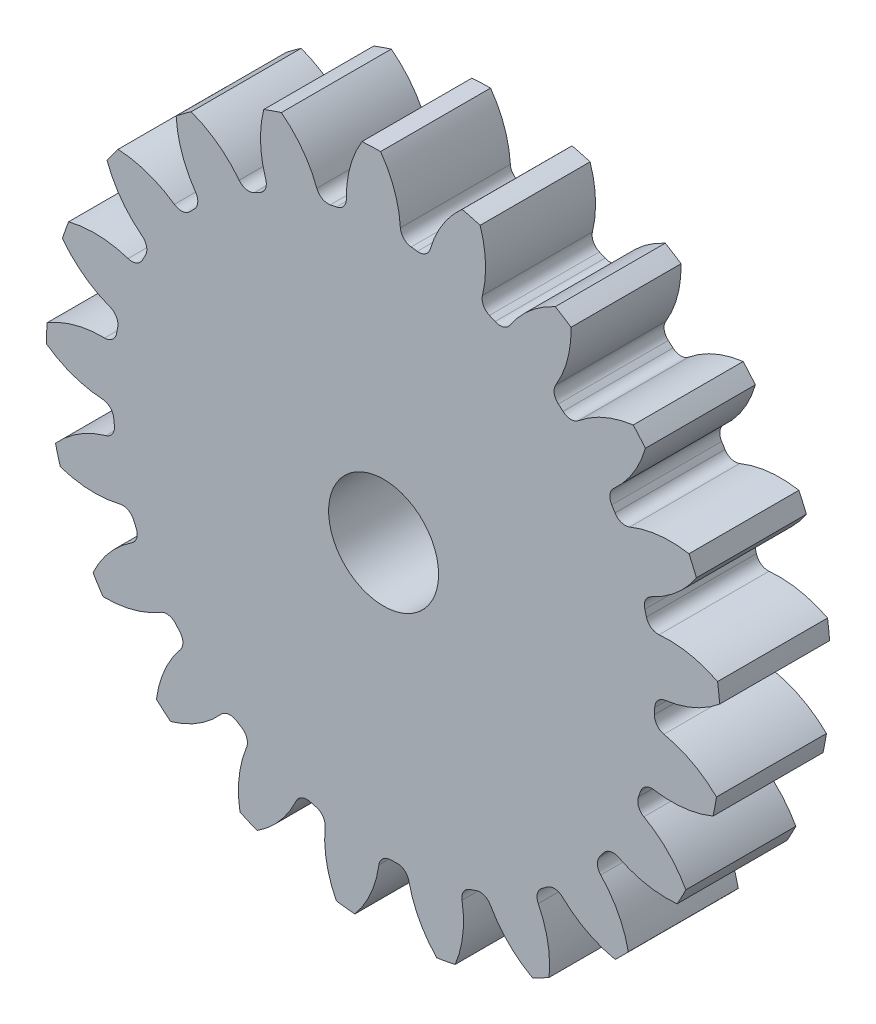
SolidWorks part; units mm, degrees
ref_plane "Front" through (0, 0, 0) normal (0, 0, 1) x (1, 0, 0)
ref_plane "Top" through (0, 0, 0) normal (0, 1, 0) x (1, 0, 0)
ref_plane "Right" through (0, 0, 0) normal (1, 0, 0) x (0, 0, -1)
sketch "Sketch3" plane through (0, 0, 0) normal (0, 0, 1) x (1, 0, 0)
  circle A0 centre (0, 0) radius 389.4667
  dimension "od" = 778.9333
extrude "gearBody" add sketch "Sketch3" along normal blind 127
sketch "Sketch2" plane through (0, 0, 0) normal (0, 0, 1) x (1, 0, 0)
  line L0 (0, 0) -> (308.7187, 127.8755) construction
  line L1 (385.75, -63.3767) -> (0, 0) construction
  line L2 (0, 0) -> (36.3143, 0) construction
  line L3 (355.3651, 12.9222) -> (353.3367, -40.0569) construction
  line L5 (354.3509, -13.5673) -> (0, 0) construction
  line L7 (0, 0) -> (334.1547, 0) construction
  arc A0 (334.0926, 6.4411) -> (332.622, -31.9682) centre (0, 0) ccw construction
  arc A1 (388.1046, 32.5444) -> (384.4799, -62.125) centre (0, 0) ccw construction
  arc A2 (355.3651, 12.9222) -> (353.3367, -40.0569) centre (0, 0) ccw construction
  arc A3 (312.8789, -15.582) -> (313.1544, -8.3875) centre (0, 0) ccw
  arc A4 (385.75, -63.3767) -> (323.7848, -29.7512) centre (298.037, -151.1068) ccw
  arc A5 (385.75, -63.3767) -> (389.4667, 33.6953) centre (0, 0) ccw
  arc A6 (389.4667, 33.6953) -> (325.1118, 4.9063) centre (308.7187, 127.8755) cw
  arc A7 (313.1544, -8.3875) -> (325.1118, 4.9063) centre (326.9332, -8.7565) cw
  arc A8 (323.7848, -29.7512) -> (312.8789, -15.582) centre (326.6456, -16.2676) cw
  point P6 (389.4667, 33.6953)
  point P22 (385.75, -63.3767)
  dimension "baseDia" = 668.3094
  dimension "od" = 778.9333
  dimension "pd" = 711.2
  dimension "rd" = 626.5333
  dimension "rFillet" = 13.7837
  dimension "pointX" = 389.4667
  dimension "pointY" = 33.6953
  dimension "CTT" = 52.9791
  dimension "flankCenterAngle" = 22.5
extrude "toothCut" cut sketch "Sketch2" along normal through all
pattern_circular "CirPattern1" count 21 over 360 about axis through (0, 0, 0) along (0, 0, 1) of "toothCut"
sketch "hub1Dia" plane through (0, 0, 0) normal (0, 0, -1) x (-1, 0, 0)
  circle A0 centre (0, 0) radius 12.7
  dimension "hub1Dia" = 25.4
sketch "hub2Dia" plane through (0, 0, 127) normal (0, 0, 1) x (1, 0, 0)
  circle A0 centre (0, 0) radius 12.7
  dimension "hub2dia" = 25.4
sketch "boreDia" plane through (0, 0, 0) normal (0, 0, 1) x (1, 0, 0)
  circle A0 centre (0, 0) radius 63.5
  dimension "boreDia" = 127
extrude "bore" cut sketch "boreDia" against normal mid plane 25400
